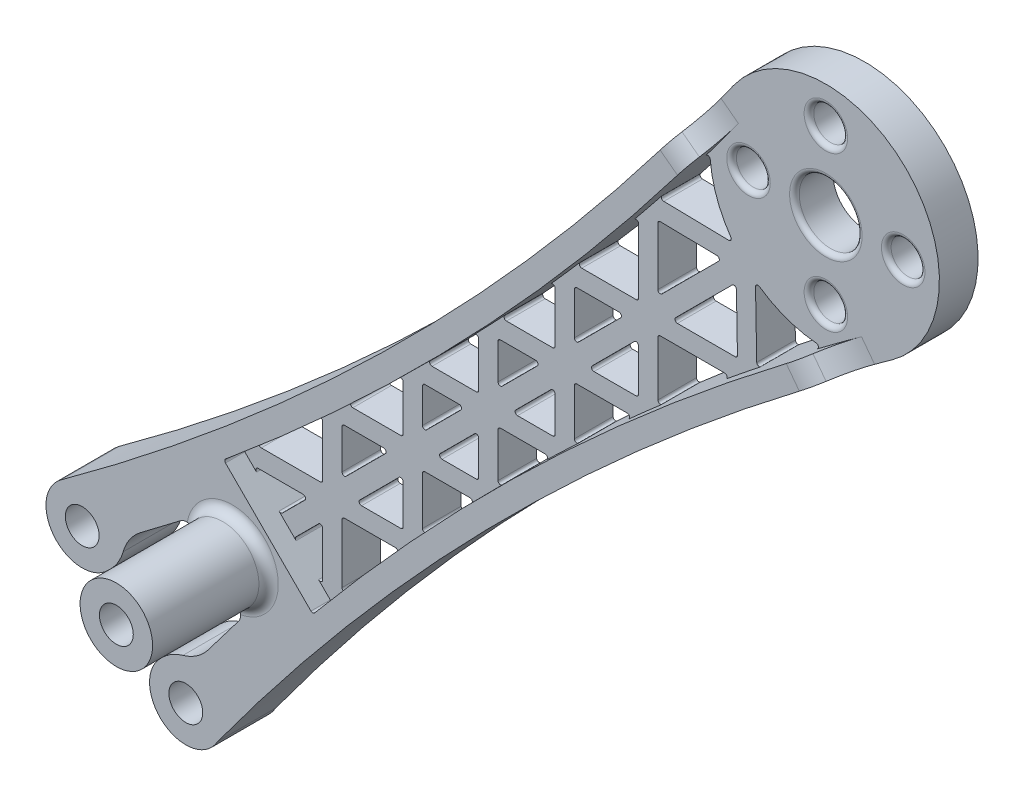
SolidWorks part; units mm, degrees
ref_plane "Front Plane" through (0, 0, 0) normal (0, 0, 1) x (1, 0, 0)
ref_plane "Top Plane" through (0, 0, 0) normal (0, 1, 0) x (1, 0, 0)
ref_plane "Right Plane" through (0, 0, 0) normal (1, 0, 0) x (0, 0, -1)
sketch "Sketch2" plane through (0, 0, 0) normal (0, 0, 1) x (1, 0, 0)
  line L0 (22.5, 22.5) -> (15.25, 15.25) construction
  line L1 (-88.3883, -88.3883) -> (88.3883, -88.3883) construction
  line L2 (-88.3883, -88.3883) -> (-88.3883, 88.3883) construction
  line L3 (88.3883, 88.3883) -> (80.3883, 88.3883) construction
  line L4 (88.3883, -88.3883) -> (88.3883, 88.3883) construction
  line L5 (-22.5, 22.5) -> (-15.25, 15.25) construction
  line L6 (-22.5, -22.5) -> (-15.25, -15.25) construction
  line L7 (15.25, -15.25) -> (22.5, -22.5) construction
  line L8 (-15.25, -15.25) -> (15.25, -15.25) construction
  line L9 (15.25, -15.25) -> (15.25, 15.25) construction
  line L10 (15.25, 15.25) -> (-15.25, 15.25) construction
  line L11 (-15.25, 15.25) -> (-15.25, -15.25) construction
  line L12 (0, 0) -> (28.9914, 28.9914) construction
  line L13 (18.875, 18.875) -> (24.1783, 13.5717) construction
  line L14 (18.875, 18.875) -> (13.4605, 24.0648) construction
  line L15 (28.9914, 28.9914) -> (32.5269, 32.5269) construction
  line L16 (16.1678, 21.4699) -> (16.4248, 21.727)
  line L17 (21.727, 16.4248) -> (21.5267, 16.2233)
  line L18 (19.4788, 26.484) -> (23.6395, 29.6392)
  line L19 (26.484, 19.4788) -> (29.6392, 23.6395)
  line L20 (33.4108, 31.643) -> (35.7339, 29.3199) construction
  line L21 (36.3374, 38.5874) -> (36.3374, 43.8702)
  line L22 (29.9911, 38.3374) -> (36.0874, 38.3374)
  line L23 (33.5876, 31.8198) -> (35.9107, 29.4967)
  line L24 (36.3374, 29.6735) -> (36.3374, 34.3197)
  line L25 (38.941, 40.0016) -> (42.9985, 44.0592) construction
  line L26 (33.5876, 32.1734) -> (35.9107, 34.4964)
  line L27 (32.1734, 33.5876) -> (34.4964, 35.9107)
  line L28 (40.0016, 38.941) -> (44.0592, 42.9985) construction
  line L29 (55.0787, 56.1393) -> (58.7151, 59.7758) construction
  line L30 (54.2251, 56.4929) -> (54.2251, 60.1294) construction
  line L31 (62.9829, 64.0436) -> (67.3465, 68.4071) construction
  line L32 (29.6735, 36.3374) -> (34.3197, 36.3374)
  line L33 (29.4967, 35.9107) -> (31.8198, 33.5876)
  line L34 (38.5874, 36.3374) -> (43.8702, 36.3374)
  line L35 (38.3374, 29.9911) -> (38.3374, 36.0874)
  line L36 (48.3269, 47.2663) -> (51.8716, 50.8109) construction
  line L37 (38.5874, 36.5874) -> (43.8702, 36.5874) construction
  line L38 (38.7642, 40.1784) -> (42.8217, 44.2359)
  line L39 (56.4929, 54.2251) -> (60.1294, 54.2251) construction
  line L40 (62.1294, 64.3971) -> (62.1294, 68.7607) construction
  line L41 (47.2663, 48.3269) -> (50.8109, 51.8716) construction
  line L42 (64.3971, 62.1294) -> (68.7607, 62.1294) construction
  line L43 (56.1393, 55.0787) -> (59.7758, 58.7151) construction
  line L44 (71.6155, 80.988) -> (78.3442, 80.8624) construction
  line L45 (32.3501, 33.4108) -> (34.6732, 35.7339) construction
  line L46 (73.0284, 70.7607) -> (78.9943, 70.7607) construction
  line L47 (79.4942, 71.27) -> (79.3849, 77.1265) construction
  line L48 (38.5874, 44.6627) -> (42.645, 44.6627)
  line L49 (63.1363, 70.7607) -> (68.7607, 70.7607) construction
  line L50 (38.3374, 40.3552) -> (38.3374, 44.4127)
  line L51 (69.2607, 62.6294) -> (69.2607, 66.9929) construction
  line L52 (52.7251, 54.7251) -> (52.7251, 59.3549) construction
  line L53 (55.3449, 62.1294) -> (60.1294, 62.1294) construction
  line L54 (44.9127, 46.9127) -> (44.9127, 51.5697) construction
  line L55 (29.3199, 35.7339) -> (31.643, 33.4108) construction
  line L56 (60.6294, 54.7251) -> (60.6294, 58.3616) construction
  line L57 (46.9127, 52.7251) -> (50.4573, 52.7251) construction
  line L58 (46.4127, 48.6805) -> (46.4127, 52.2251) construction
  line L59 (48.6805, 46.4127) -> (52.2251, 46.4127) construction
  line L60 (52.7251, 46.9127) -> (52.7251, 50.4573) construction
  line L61 (70.7607, 73.0284) -> (70.7607, 78.9943) construction
  line L62 (71.27, 79.4942) -> (77.1265, 79.3849) construction
  line L63 (33.4108, 32.3501) -> (35.7339, 34.6732) construction
  line L64 (71.2607, 69.2607) -> (77.9331, 69.2607) construction
  line L65 (80.988, 71.6155) -> (80.8624, 78.3442) construction
  line L66 (40.1784, 38.7642) -> (44.2359, 42.8217)
  line L67 (62.6294, 69.2607) -> (66.9929, 69.2607) construction
  line L68 (44.6627, 38.5874) -> (44.6627, 42.645)
  line L69 (70.7607, 63.1363) -> (70.7607, 68.7607) construction
  line L70 (40.3552, 38.3374) -> (44.4127, 38.3374)
  line L71 (54.7251, 60.6294) -> (58.3616, 60.6294) construction
  line L72 (44.6627, 46.9127) -> (44.6627, 51.5697)
  line L73 (62.1294, 55.3449) -> (62.1294, 60.1294) construction
  line L74 (47.6486, 54.2251) -> (52.2251, 54.2251) construction
  line L75 (39.453, 46.6627) -> (44.4127, 46.6627)
  line L76 (46.6627, 39.453) -> (46.6627, 44.4127)
  line L77 (54.2251, 47.6486) -> (54.2251, 52.2251) construction
  line L78 (38.0874, 40.3552) -> (38.0874, 44.4127) construction
  line L79 (38.5874, 44.9127) -> (42.645, 44.9127) construction
  line L80 (44.9127, 38.5874) -> (44.9127, 42.645) construction
  line L81 (40.3552, 38.0874) -> (44.4127, 38.0874) construction
  line L82 (29.9911, 38.0874) -> (36.0874, 38.0874) construction
  line L83 (36.5874, 29.6735) -> (36.5874, 34.3197) construction
  line L84 (46.9127, 44.6627) -> (51.5697, 44.6627)
  line L85 (39.453, 46.4127) -> (44.4127, 46.4127) construction
  line L86 (46.4127, 39.453) -> (46.4127, 44.4127) construction
  line L87 (48.5037, 47.0895) -> (52.0483, 50.6341)
  line L88 (29.6735, 36.5874) -> (34.3197, 36.5874) construction
  line L89 (38.0874, 29.9911) -> (38.0874, 36.0874) construction
  line L90 (64.0436, 62.9829) -> (68.4071, 67.3465) construction
  line L91 (52.4751, 46.9127) -> (52.4751, 50.4573)
  line L92 (54.7251, 52.7251) -> (59.3549, 52.7251) construction
  line L93 (48.6805, 46.6627) -> (52.2251, 46.6627)
  line L94 (47.0895, 48.5037) -> (50.6341, 52.0483)
  line L95 (62.6294, 60.6294) -> (67.8495, 60.6294) construction
  line L96 (46.9127, 52.4751) -> (50.4573, 52.4751)
  line L97 (46.6627, 48.6805) -> (46.6627, 52.2251)
  line L98 (54.4751, 47.6486) -> (54.4751, 52.2251)
  line L99 (54.7251, 52.4751) -> (59.3549, 52.4751)
  line L100 (52.4751, 54.7251) -> (52.4751, 59.3549)
  line L101 (72.6749, 71.6142) -> (78.5314, 77.4707) construction
  line L102 (46.9127, 44.9127) -> (51.5697, 44.9127) construction
  line L103 (36.5874, 38.5874) -> (36.5874, 43.8702) construction
  line L104 (71.6142, 72.6749) -> (77.4707, 78.5314) construction
  line L105 (47.6486, 54.4751) -> (52.2251, 54.4751)
  line L106 (69.2607, 71.2607) -> (69.2607, 77.9331) construction
  line L107 (54.9019, 56.3161) -> (58.5384, 59.9526)
  line L108 (54.7251, 60.3794) -> (58.3616, 60.3794)
  line L109 (54.4751, 56.4929) -> (54.4751, 60.1294)
  line L110 (56.4929, 54.4751) -> (60.1294, 54.4751)
  line L111 (60.3794, 54.7251) -> (60.3794, 58.3616)
  line L112 (56.3161, 54.9019) -> (59.9526, 58.5384)
  line L113 (62.3794, 55.3449) -> (62.3794, 60.1294)
  line L114 (62.6294, 60.3794) -> (67.8495, 60.3794)
  line L115 (55.3449, 62.3794) -> (60.1294, 62.3794)
  line L116 (60.6294, 62.6294) -> (60.6294, 67.8495) construction
  line L117 (60.3794, 62.6294) -> (60.3794, 67.8495)
  line L118 (62.8061, 64.2203) -> (67.1697, 68.5839)
  line L119 (62.6294, 69.0107) -> (66.9929, 69.0107)
  line L120 (62.3794, 64.3971) -> (62.3794, 68.7607)
  line L121 (64.3971, 62.3794) -> (68.7607, 62.3794)
  line L122 (69.0107, 62.6294) -> (69.0107, 66.9929)
  line L123 (64.2203, 62.8061) -> (68.5839, 67.1697)
  line L124 (71.2607, 69.0107) -> (77.9331, 69.0107)
  line L125 (71.0107, 63.1363) -> (71.0107, 68.7607)
  line L126 (63.1363, 71.0107) -> (68.7607, 71.0107)
  line L127 (69.0107, 71.2607) -> (69.0107, 77.9331)
  line L128 (73.0284, 71.0107) -> (78.9943, 71.0107)
  line L129 (79.2442, 71.2653) -> (79.1349, 77.1218)
  line L130 (72.8517, 71.4375) -> (78.7082, 77.294)
  line L131 (71.0107, 73.0284) -> (71.0107, 78.9943)
  line L132 (71.2653, 79.2442) -> (77.1218, 79.1349)
  line L133 (71.4375, 72.8517) -> (77.294, 78.7082)
  line L134 (81.238, 71.6202) -> (81.1123, 78.3489)
  line L135 (71.6202, 81.238) -> (78.3489, 81.1123)
  circle A0 centre (-22.5, 22.5) radius 1.75 construction
  circle A1 centre (22.5, 22.5) radius 1.75 construction
  circle A2 centre (22.5, -22.5) radius 1.75 construction
  circle A3 centre (-22.5, -22.5) radius 1.75 construction
  circle A4 centre (-15.25, 15.25) radius 1.75 construction
  circle A5 centre (15.25, 15.25) radius 1.75 construction
  circle A6 centre (15.25, -15.25) radius 1.75 construction
  circle A7 centre (-15.25, -15.25) radius 1.75 construction
  circle A8 centre (88.3883, 88.3883) radius 3.25
  circle A9 centre (13.4605, 24.0648) radius 1.75
  circle A10 centre (24.1783, 13.5717) radius 1.75
  circle A11 centre (28.9914, 28.9914) radius 1.75
  arc A12 (11.2589, 27.1004) -> (16.1678, 21.4699) centre (13.4605, 24.0648) ccw
  arc A13 (21.5267, 16.2233) -> (27.4519, 11.7425) centre (24.1783, 13.5717) ccw
  arc A14 (25.2432, 28.8737) -> (28.8737, 25.2432) centre (28.9914, 28.9914) ccw
  circle A15 centre (80.3883, 88.3883) radius 1.75
  circle A16 centre (88.3883, 96.3883) radius 1.75
  circle A17 centre (96.3883, 88.3883) radius 1.75
  circle A18 centre (88.3883, 80.3883) radius 1.75
  arc A19 (95.2099, 78.8213) -> (78.8213, 95.2099) centre (88.3883, 88.3883) ccw
  arc A20 (11.2589, 27.1004) -> (78.8213, 95.2099) centre (-163.3974, 267.9184) ccw
  arc A21 (27.1004, 11.2589) -> (95.2099, 78.8213) centre (267.9184, -163.3974) cw
  arc A22 (23.8811, 17.6945) -> (26.484, 19.4788) centre (22.5, 22.5) ccw
  arc A23 (19.4788, 26.484) -> (17.6945, 23.8811) centre (22.5, 22.5) ccw
  arc A24 (29.6392, 23.6395) -> (28.8737, 25.2432) centre (28.8424, 24.2437) ccw
  arc A25 (23.6395, 29.6392) -> (25.2432, 28.8737) centre (24.2437, 28.8424) cw
  arc A26 (23.8811, 17.6945) -> (21.727, 16.4248) centre (25.2623, 12.8891) ccw
  arc A27 (16.4248, 21.727) -> (17.6945, 23.8811) centre (12.8891, 25.2623) ccw
  arc A28 (29.6688, 38.9697) -> (35.7549, 44.2436) centre (-163.3974, 267.9184) ccw construction
  arc A29 (25.4814, 12.4331) -> (25.7511, 12.8044) centre (267.9184, -163.3974) cw
  arc A30 (38.9697, 29.6688) -> (44.2436, 35.7549) centre (267.9184, -163.3974) cw construction
  arc A31 (81.6491, 78.7631) -> (87.4202, 76.6783) centre (88.3883, 88.3883) ccw construction
  arc A32 (76.6783, 87.4202) -> (78.7631, 81.6491) centre (88.3883, 88.3883) ccw construction
  arc A33 (25.4814, 12.4331) -> (94.0488, 80.4497) centre (267.9184, -163.3974) cw construction
  arc A34 (71.2332, 81.7987) -> (75.7807, 87.6799) centre (-163.3974, 267.9184) ccw construction
  arc A35 (81.7987, 71.2332) -> (87.6799, 75.7807) centre (267.9184, -163.3974) cw construction
  arc A36 (62.7588, 71.5885) -> (68.3737, 78.2497) centre (-163.3974, 267.9184) ccw construction
  arc A37 (71.5885, 62.7588) -> (78.2497, 68.3737) centre (267.9184, -163.3974) cw construction
  arc A38 (54.9803, 62.9715) -> (59.7568, 68.1829) centre (-163.3974, 267.9184) ccw construction
  arc A39 (47.2968, 55.0804) -> (51.8657, 59.7025) centre (-163.3974, 267.9184) ccw construction
  arc A40 (55.0804, 47.2968) -> (59.7025, 51.8657) centre (267.9184, -163.3974) cw construction
  arc A41 (39.1149, 47.2811) -> (44.0664, 51.9303) centre (-163.3974, 267.9184) ccw construction
  arc A42 (47.2811, 39.1149) -> (51.9303, 44.0664) centre (267.9184, -163.3974) cw construction
  arc A43 (62.9715, 54.9803) -> (68.1829, 59.7568) centre (267.9184, -163.3974) cw construction
  arc A44 (71.6155, 80.988) -> (71.2332, 81.7987) centre (71.6249, 81.4879) cw construction
  arc A45 (78.3442, 80.8624) -> (78.7631, 81.6491) centre (78.3536, 81.3623) ccw construction
  arc A46 (76.6783, 87.4202) -> (75.7807, 87.6799) centre (76.18, 87.379) ccw construction
  arc A47 (87.6799, 75.7807) -> (87.4202, 76.6783) centre (87.379, 76.18) ccw construction
  arc A48 (81.6491, 78.7631) -> (80.8624, 78.3442) centre (81.3623, 78.3536) ccw construction
  arc A49 (78.5314, 77.4707) -> (79.3849, 77.1265) centre (78.8849, 77.1172) cw construction
  arc A50 (77.4707, 78.5314) -> (77.1265, 79.3849) centre (77.1172, 78.8849) ccw construction
  arc A51 (70.7607, 78.9943) -> (71.27, 79.4942) centre (71.2607, 78.9943) cw construction
  arc A52 (68.3737, 78.2497) -> (69.2607, 77.9331) centre (68.7607, 77.9331) cw construction
  arc A53 (69.2607, 66.9929) -> (68.4071, 67.3465) centre (68.7607, 66.9929) ccw construction
  arc A54 (67.3465, 68.4071) -> (66.9929, 69.2607) centre (66.9929, 68.7607) ccw construction
  arc A55 (60.6294, 62.6294) -> (60.1294, 62.1294) centre (60.1294, 62.6294) cw construction
  arc A56 (69.2607, 71.2607) -> (68.7607, 70.7607) centre (68.7607, 71.2607) cw construction
  arc A57 (70.7607, 68.7607) -> (71.2607, 69.2607) centre (71.2607, 68.7607) cw construction
  arc A58 (71.6142, 72.6749) -> (70.7607, 73.0284) centre (71.2607, 73.0284) cw construction
  arc A59 (78.2497, 68.3737) -> (77.9331, 69.2607) centre (77.9331, 68.7607) ccw construction
  arc A60 (62.1294, 68.7607) -> (62.6294, 69.2607) centre (62.6294, 68.7607) cw construction
  arc A61 (72.6749, 71.6142) -> (73.0284, 70.7607) centre (73.0284, 71.2607) ccw construction
  arc A62 (68.7607, 62.1294) -> (69.2607, 62.6294) centre (68.7607, 62.6294) ccw construction
  arc A63 (80.988, 71.6155) -> (81.7987, 71.2332) centre (81.4879, 71.6249) ccw construction
  arc A64 (64.3971, 62.1294) -> (64.0436, 62.9829) centre (64.3971, 62.6294) cw construction
  arc A65 (78.9943, 70.7607) -> (79.4942, 71.27) centre (78.9943, 71.2607) ccw construction
  arc A66 (62.9829, 64.0436) -> (62.1294, 64.3971) centre (62.6294, 64.3971) cw construction
  arc A67 (59.7568, 68.1829) -> (60.6294, 67.8495) centre (60.1294, 67.8495) cw construction
  arc A68 (54.9803, 62.9715) -> (55.3449, 62.1294) centre (55.3449, 62.6294) ccw construction
  arc A69 (63.1363, 70.7607) -> (62.7588, 71.5885) centre (63.1363, 71.2607) cw construction
  arc A70 (71.5885, 62.7588) -> (70.7607, 63.1363) centre (71.2607, 63.1363) cw construction
  arc A71 (68.1829, 59.7568) -> (67.8495, 60.6294) centre (67.8495, 60.1294) ccw construction
  arc A72 (58.3616, 60.6294) -> (58.7151, 59.7758) centre (58.3616, 60.1294) cw construction
  arc A73 (59.7758, 58.7151) -> (60.6294, 58.3616) centre (60.1294, 58.3616) cw construction
  arc A74 (54.2251, 60.1294) -> (54.7251, 60.6294) centre (54.7251, 60.1294) cw construction
  arc A75 (50.8109, 51.8716) -> (50.4573, 52.7251) centre (50.4573, 52.2251) ccw construction
  arc A76 (51.8716, 50.8109) -> (52.7251, 50.4573) centre (52.2251, 50.4573) cw construction
  arc A77 (62.6294, 60.6294) -> (62.1294, 60.1294) centre (62.6294, 60.1294) ccw construction
  arc A78 (52.7251, 54.7251) -> (52.2251, 54.2251) centre (52.2251, 54.7251) cw construction
  arc A79 (52.2251, 46.4127) -> (52.7251, 46.9127) centre (52.2251, 46.9127) ccw construction
  arc A80 (46.9127, 52.7251) -> (46.4127, 52.2251) centre (46.9127, 52.2251) ccw construction
  arc A81 (60.1294, 54.2251) -> (60.6294, 54.7251) centre (60.1294, 54.7251) ccw construction
  arc A82 (54.2251, 52.2251) -> (54.7251, 52.7251) centre (54.7251, 52.2251) cw construction
  arc A83 (55.0804, 47.2968) -> (54.2251, 47.6486) centre (54.7251, 47.6486) cw construction
  arc A84 (51.9303, 44.0664) -> (51.5697, 44.9127) centre (51.5697, 44.4127) ccw construction
  arc A85 (56.4929, 54.2251) -> (56.1393, 55.0787) centre (56.4929, 54.7251) cw construction
  arc A86 (55.0787, 56.1393) -> (54.2251, 56.4929) centre (54.7251, 56.4929) cw construction
  arc A87 (59.7025, 51.8657) -> (59.3549, 52.7251) centre (59.3549, 52.2251) ccw construction
  arc A88 (52.7251, 59.3549) -> (51.8657, 59.7025) centre (52.2251, 59.3549) ccw construction
  arc A89 (44.9127, 51.5697) -> (44.0664, 51.9303) centre (44.4127, 51.5697) ccw construction
  arc A90 (47.6486, 54.2251) -> (47.2968, 55.0804) centre (47.6486, 54.7251) cw construction
  arc A91 (62.1294, 55.3449) -> (62.9715, 54.9803) centre (62.6294, 55.3449) ccw construction
  arc A92 (38.9697, 29.6688) -> (38.0874, 29.9911) centre (38.5874, 29.9911) cw construction
  arc A93 (36.5874, 29.6735) -> (35.7339, 29.3199) centre (36.0874, 29.6735) cw construction
  arc A94 (33.4108, 32.3501) -> (33.4108, 31.643) centre (33.7643, 31.9966) ccw construction
  arc A95 (44.9127, 38.5874) -> (44.4127, 38.0874) centre (44.4127, 38.5874) cw construction
  arc A96 (46.9127, 44.9127) -> (46.4127, 44.4127) centre (46.9127, 44.4127) ccw construction
  arc A97 (44.9127, 42.645) -> (44.0592, 42.9985) centre (44.4127, 42.645) ccw construction
  arc A98 (42.645, 44.9127) -> (42.9985, 44.0592) centre (42.645, 44.4127) cw construction
  arc A99 (36.5874, 34.3197) -> (35.7339, 34.6732) centre (36.0874, 34.3197) ccw construction
  arc A100 (44.9127, 46.9127) -> (44.4127, 46.4127) centre (44.4127, 46.9127) cw construction
  arc A101 (38.5874, 36.5874) -> (38.0874, 36.0874) centre (38.5874, 36.0874) ccw construction
  arc A102 (46.4127, 48.6805) -> (47.2663, 48.3269) centre (46.9127, 48.6805) ccw construction
  arc A103 (48.3269, 47.2663) -> (48.6805, 46.4127) centre (48.6805, 46.9127) ccw construction
  arc A104 (40.3552, 38.0874) -> (40.0016, 38.941) centre (40.3552, 38.5874) cw construction
  arc A105 (47.2811, 39.1149) -> (46.4127, 39.453) centre (46.9127, 39.453) cw construction
  arc A106 (39.1149, 47.2811) -> (39.453, 46.4127) centre (39.453, 46.9127) ccw construction
  arc A107 (44.2436, 35.7549) -> (43.8702, 36.5874) centre (43.8702, 36.0874) ccw construction
  arc A108 (38.941, 40.0016) -> (38.0874, 40.3552) centre (38.5874, 40.3552) cw construction
  arc A109 (38.0874, 44.4127) -> (38.5874, 44.9127) centre (38.5874, 44.4127) cw construction
  arc A110 (36.5874, 43.8702) -> (35.7549, 44.2436) centre (36.0874, 43.8702) ccw construction
  arc A111 (36.5874, 38.5874) -> (36.0874, 38.0874) centre (36.0874, 38.5874) cw construction
  arc A112 (34.6732, 35.7339) -> (34.3197, 36.5874) centre (34.3197, 36.0874) ccw construction
  arc A113 (32.3501, 33.4108) -> (31.643, 33.4108) centre (31.9966, 33.7643) cw construction
  arc A114 (29.9911, 38.0874) -> (29.6688, 38.9697) centre (29.9911, 38.5874) cw construction
  arc A115 (29.3199, 35.7339) -> (29.6735, 36.5874) centre (29.6735, 36.0874) cw construction
  arc A116 (29.8299, 38.7786) -> (35.9212, 44.0569) centre (-163.3974, 267.9184) ccw
  arc A117 (36.3374, 43.8702) -> (35.9212, 44.0569) centre (36.0874, 43.8702) ccw
  arc A118 (36.3374, 38.5874) -> (36.0874, 38.3374) centre (36.0874, 38.5874) cw
  arc A119 (29.9911, 38.3374) -> (29.8299, 38.7786) centre (29.9911, 38.5874) cw
  arc A120 (36.3374, 29.6735) -> (35.9107, 29.4967) centre (36.0874, 29.6735) cw
  arc A121 (36.3374, 34.3197) -> (35.9107, 34.4964) centre (36.0874, 34.3197) ccw
  arc A122 (33.5876, 32.1734) -> (33.5876, 31.8198) centre (33.7643, 31.9966) ccw
  arc A123 (34.4964, 35.9107) -> (34.3197, 36.3374) centre (34.3197, 36.0874) ccw
  arc A124 (29.4967, 35.9107) -> (29.6735, 36.3374) centre (29.6735, 36.0874) cw
  arc A125 (32.1734, 33.5876) -> (31.8198, 33.5876) centre (31.9966, 33.7643) cw
  arc A126 (44.0569, 35.9212) -> (43.8702, 36.3374) centre (43.8702, 36.0874) ccw
  arc A127 (38.7786, 29.8299) -> (44.0569, 35.9212) centre (267.9184, -163.3974) cw
  arc A128 (38.7786, 29.8299) -> (38.3374, 29.9911) centre (38.5874, 29.9911) cw
  arc A129 (38.5874, 36.3374) -> (38.3374, 36.0874) centre (38.5874, 36.0874) ccw
  arc A130 (42.645, 44.6627) -> (42.8217, 44.2359) centre (42.645, 44.4127) cw
  arc A131 (38.3374, 44.4127) -> (38.5874, 44.6627) centre (38.5874, 44.4127) cw
  arc A132 (38.7642, 40.1784) -> (38.3374, 40.3552) centre (38.5874, 40.3552) cw
  arc A133 (44.6627, 42.645) -> (44.2359, 42.8217) centre (44.4127, 42.645) ccw
  arc A134 (44.6627, 38.5874) -> (44.4127, 38.3374) centre (44.4127, 38.5874) cw
  arc A135 (40.3552, 38.3374) -> (40.1784, 38.7642) centre (40.3552, 38.5874) cw
  arc A136 (44.6627, 51.5697) -> (44.2395, 51.75) centre (44.4127, 51.5697) ccw
  arc A137 (39.284, 47.0969) -> (44.2395, 51.75) centre (-163.3974, 267.9184) ccw
  arc A138 (39.284, 47.0969) -> (39.453, 46.6627) centre (39.453, 46.9127) ccw
  arc A139 (44.6627, 46.9127) -> (44.4127, 46.6627) centre (44.4127, 46.9127) cw
  arc A140 (46.9127, 44.6627) -> (46.6627, 44.4127) centre (46.9127, 44.4127) ccw
  arc A141 (51.75, 44.2395) -> (51.5697, 44.6627) centre (51.5697, 44.4127) ccw
  arc A142 (47.0969, 39.284) -> (51.75, 44.2395) centre (267.9184, -163.3974) cw
  arc A143 (47.0969, 39.284) -> (46.6627, 39.453) centre (46.9127, 39.453) cw
  arc A144 (52.0483, 50.6341) -> (52.4751, 50.4573) centre (52.2251, 50.4573) cw
  arc A145 (52.2251, 46.6627) -> (52.4751, 46.9127) centre (52.2251, 46.9127) ccw
  arc A146 (48.5037, 47.0895) -> (48.6805, 46.6627) centre (48.6805, 46.9127) ccw
  arc A147 (50.6341, 52.0483) -> (50.4573, 52.4751) centre (50.4573, 52.2251) ccw
  arc A148 (46.9127, 52.4751) -> (46.6627, 52.2251) centre (46.9127, 52.2251) ccw
  arc A149 (46.6627, 48.6805) -> (47.0895, 48.5037) centre (46.9127, 48.6805) ccw
  arc A150 (54.4751, 52.2251) -> (54.7251, 52.4751) centre (54.7251, 52.2251) cw
  arc A151 (59.5287, 52.0454) -> (59.3549, 52.4751) centre (59.3549, 52.2251) ccw
  arc A152 (54.9028, 47.4727) -> (59.5287, 52.0454) centre (267.9184, -163.3974) cw
  arc A153 (54.9028, 47.4727) -> (54.4751, 47.6486) centre (54.7251, 47.6486) cw
  arc A154 (52.4751, 59.3549) -> (52.0454, 59.5287) centre (52.2251, 59.3549) ccw
  arc A155 (47.4727, 54.9028) -> (52.0454, 59.5287) centre (-163.3974, 267.9184) ccw
  arc A156 (47.6486, 54.4751) -> (47.4727, 54.9028) centre (47.6486, 54.7251) cw
  arc A157 (52.4751, 54.7251) -> (52.2251, 54.4751) centre (52.2251, 54.7251) cw
  arc A158 (58.3616, 60.3794) -> (58.5384, 59.9526) centre (58.3616, 60.1294) cw
  arc A159 (54.4751, 60.1294) -> (54.7251, 60.3794) centre (54.7251, 60.1294) cw
  arc A160 (54.9019, 56.3161) -> (54.4751, 56.4929) centre (54.7251, 56.4929) cw
  arc A161 (60.1294, 54.4751) -> (60.3794, 54.7251) centre (60.1294, 54.7251) ccw
  arc A162 (59.9526, 58.5384) -> (60.3794, 58.3616) centre (60.1294, 58.3616) cw
  arc A163 (56.4929, 54.4751) -> (56.3161, 54.9019) centre (56.4929, 54.7251) cw
  arc A164 (62.6294, 60.3794) -> (62.3794, 60.1294) centre (62.6294, 60.1294) ccw
  arc A165 (68.0162, 59.9431) -> (67.8495, 60.3794) centre (67.8495, 60.1294) ccw
  arc A166 (62.8004, 55.1626) -> (68.0162, 59.9431) centre (267.9184, -163.3974) cw
  arc A167 (62.3794, 55.3449) -> (62.8004, 55.1626) centre (62.6294, 55.3449) ccw
  arc A168 (60.3794, 62.6294) -> (60.1294, 62.3794) centre (60.1294, 62.6294) cw
  arc A169 (59.9431, 68.0162) -> (60.3794, 67.8495) centre (60.1294, 67.8495) cw
  arc A170 (55.1626, 62.8004) -> (59.9431, 68.0162) centre (-163.3974, 267.9184) ccw
  arc A171 (55.1626, 62.8004) -> (55.3449, 62.3794) centre (55.3449, 62.6294) ccw
  arc A172 (67.1697, 68.5839) -> (66.9929, 69.0107) centre (66.9929, 68.7607) ccw
  arc A173 (62.3794, 68.7607) -> (62.6294, 69.0107) centre (62.6294, 68.7607) cw
  arc A174 (62.8061, 64.2203) -> (62.3794, 64.3971) centre (62.6294, 64.3971) cw
  arc A175 (68.7607, 62.3794) -> (69.0107, 62.6294) centre (68.7607, 62.6294) ccw
  arc A176 (69.0107, 66.9929) -> (68.5839, 67.1697) centre (68.7607, 66.9929) ccw
  arc A177 (64.3971, 62.3794) -> (64.2203, 62.8061) centre (64.3971, 62.6294) cw
  arc A178 (78.0914, 68.5672) -> (77.9331, 69.0107) centre (77.9331, 68.7607) ccw
  arc A179 (71.4246, 62.9475) -> (78.0914, 68.5672) centre (267.9184, -163.3974) cw
  arc A180 (71.4246, 62.9475) -> (71.0107, 63.1363) centre (71.2607, 63.1363) cw
  arc A181 (71.0107, 68.7607) -> (71.2607, 69.0107) centre (71.2607, 68.7607) cw
  arc A182 (69.0107, 71.2607) -> (68.7607, 71.0107) centre (68.7607, 71.2607) cw
  arc A183 (68.5672, 78.0914) -> (69.0107, 77.9331) centre (68.7607, 77.9331) cw
  arc A184 (62.9475, 71.4246) -> (68.5672, 78.0914) centre (-163.3974, 267.9184) ccw
  arc A185 (63.1363, 71.0107) -> (62.9475, 71.4246) centre (63.1363, 71.2607) cw
  arc A186 (78.9943, 71.0107) -> (79.2442, 71.2653) centre (78.9943, 71.2607) ccw
  arc A187 (78.7082, 77.294) -> (79.1349, 77.1218) centre (78.8849, 77.1172) cw
  arc A188 (72.8517, 71.4375) -> (73.0284, 71.0107) centre (73.0284, 71.2607) ccw
  arc A189 (71.0107, 78.9943) -> (71.2653, 79.2442) centre (71.2607, 78.9943) cw
  arc A190 (77.294, 78.7082) -> (77.1218, 79.1349) centre (77.1172, 78.8849) ccw
  arc A191 (71.4375, 72.8517) -> (71.0107, 73.0284) centre (71.2607, 73.0284) cw
  arc A192 (81.5057, 78.5583) -> (81.1123, 78.3489) centre (81.3623, 78.3536) ccw
  arc A193 (81.5057, 78.5583) -> (87.3996, 76.4291) centre (88.3883, 88.3883) ccw
  arc A194 (87.5295, 75.9803) -> (87.3996, 76.4291) centre (87.379, 76.18) ccw
  arc A195 (81.6433, 71.429) -> (87.5295, 75.9803) centre (267.9184, -163.3974) cw
  arc A196 (81.238, 71.6202) -> (81.6433, 71.429) centre (81.4879, 71.6249) ccw
  arc A197 (78.3489, 81.1123) -> (78.5583, 81.5057) centre (78.3536, 81.3623) ccw
  arc A198 (76.4291, 87.3996) -> (78.5583, 81.5057) centre (88.3883, 88.3883) ccw
  arc A199 (76.4291, 87.3996) -> (75.9803, 87.5295) centre (76.18, 87.379) ccw
  arc A200 (71.429, 81.6433) -> (75.9803, 87.5295) centre (-163.3974, 267.9184) ccw
  arc A201 (71.6202, 81.238) -> (71.429, 81.6433) centre (71.6249, 81.4879) cw
  point P0 (0, 0)
  point P6 (0, 0)
  point P15 (0, 0)
  point P39 (83.085, 93.6916)
  point P40 (23.6881, 34.2947)
  point P47 (93.6916, 83.085)
  point P48 (34.2947, 23.6881)
  point P63 (31.9794, 26.7255)
  point P66 (26.7255, 31.9794)
  point P71 (-163.3974, 267.9184)
  point P72 (12.4331, 25.4814)
  point P73 (80.4497, 94.0488)
  point P120 (70.6029, 81.0069)
  point P126 (29.8191, 34.7044)
  point P127 (31.2424, 40.0163)
  point P128 (31.3972, 39.3343)
  point P129 (30.8517, 39.9712)
  point P196 (81.0069, 70.6029)
  point P199 (63.19, 62.1294)
  point P210 (62.0375, 70.7607)
  point P243 (55.2858, 54.2251)
  point P254 (46.4293, 54.2251)
  point P257 (62.1294, 54.1869)
  point P280 (46.4127, 47.4734)
  point P285 (39.1481, 38.0874)
  dimension "D1" = 4
  dimension "D3" = 2
extrude "Boss-Extrude2" add sketch "Sketch2" along normal blind 6
sketch "Sketch4" plane through (0, 0, 6) normal (0, 0, 1) x (1, 0, 0)
  line L6 (28.9914, 28.9914) -> (32.5269, 32.5269) construction
  line L7 (32.5269, 32.5269) -> (36.9496, 28.1042) construction
  line L8 (32.5269, 32.5269) -> (28.1042, 36.9496) construction
  line L9 (32.7037, 32.7037) -> (37.1264, 28.281)
  line L10 (32.7037, 32.7037) -> (28.281, 37.1264)
  arc A17 (37.6875, 28.138) -> (36.9496, 28.1042) centre (37.3032, 28.4578) cw construction
  arc A18 (28.138, 37.6875) -> (75.7807, 87.6799) centre (-163.3974, 267.9184) ccw construction
  arc A19 (76.6783, 87.4202) -> (87.4202, 76.6783) centre (88.3883, 88.3883) ccw construction
  arc A20 (28.138, 37.6875) -> (28.1042, 36.9496) centre (28.4578, 37.3032) ccw construction
  arc A21 (87.6799, 75.7807) -> (37.6875, 28.138) centre (267.9184, -163.3974) ccw construction
  arc A22 (87.4202, 76.6783) -> (87.6799, 75.7807) centre (87.379, 76.18) cw construction
  arc A23 (75.7807, 87.6799) -> (76.6783, 87.4202) centre (76.18, 87.379) cw construction
  arc A24 (28.2979, 37.4953) -> (75.9803, 87.5295) centre (-163.3974, 267.9184) ccw
  arc A25 (75.9803, 87.5295) -> (76.4291, 87.3996) centre (76.18, 87.379) cw
  arc A26 (76.4291, 87.3996) -> (87.3996, 76.4291) centre (88.3883, 88.3883) ccw
  arc A27 (87.3996, 76.4291) -> (87.5295, 75.9803) centre (87.379, 76.18) cw
  arc A28 (87.5295, 75.9803) -> (37.4953, 28.2979) centre (267.9184, -163.3974) ccw
  arc A29 (37.4953, 28.2979) -> (37.1264, 28.281) centre (37.3032, 28.4578) cw
  arc A30 (28.2979, 37.4953) -> (28.281, 37.1264) centre (28.4578, 37.3032) ccw
  dimension "D1" = 0.5
extrude "Cut-Extrude2" cut sketch "Sketch4" against normal blind 2
sketch "Sketch5" plane through (0, 0, 6) normal (0, 0, 1) x (1, 0, 0)
  line L0 (76.4498, 87.1757) -> (74.1137, 88.9362)
  line L1 (88.3883, 88.3883) -> (28.9914, 28.9914) construction
  line L2 (74.1137, 88.9362) -> (76.0866, 96.7886)
  line L3 (76.0866, 96.7886) -> (82.0525, 98.2838)
  line L4 (96.7886, 76.0866) -> (98.2838, 82.0525)
  line L5 (88.9362, 74.1137) -> (96.7886, 76.0866)
  line L6 (87.1757, 76.4498) -> (88.9362, 74.1137)
  arc A0 (76.7244, 86.9688) -> (86.9688, 76.7244) centre (88.3883, 88.3883) ccw construction
  arc A2 (98.2838, 82.0525) -> (82.0525, 98.2838) centre (88.3883, 88.3883) ccw
  arc A3 (76.4498, 87.1757) -> (87.1757, 76.4498) centre (88.3883, 88.3883) ccw
  arc A4 (76.4762, 86.9386) -> (86.9386, 76.4762) centre (88.3883, 88.3883) ccw construction
extrude "Cut-Extrude3" cut sketch "Sketch5" against normal blind 2
fillet "Fillet9" radius 9 2 edges at (88.2065, 75.0819, 4) (75.0819, 88.2065, 4)
fillet "Fillet10" radius 5 2 edges at (88.2065, 75.0819, 6) (75.0819, 88.2065, 6)
fillet "Fillet12" radius 0.5 1 edges at (98.1383, 88.3883, 4)
fillet "Fillet13" radius 0.5 1 edges at (90.1383, 96.3883, 4)
fillet "Fillet14" radius 0.5 1 edges at (91.6383, 88.3883, 4)
fillet "Fillet15" radius 0.5 1 edges at (82.1383, 88.3883, 4)
fillet "Fillet16" radius 0.5 1 edges at (90.1383, 80.3883, 4)
sketch "Sketch6" plane through (0, 0, 6) normal (0, 0, 1) x (1, 0, 0)
  circle A0 centre (28.9914, 28.9914) radius 1.75
  circle A1 centre (28.9914, 28.9914) radius 3.75
extrude "Boss-Extrude3" add sketch "Sketch6" along normal blind 12
fillet "Fillet21" radius 1 1 edges at (31.643, 31.643, 6)
